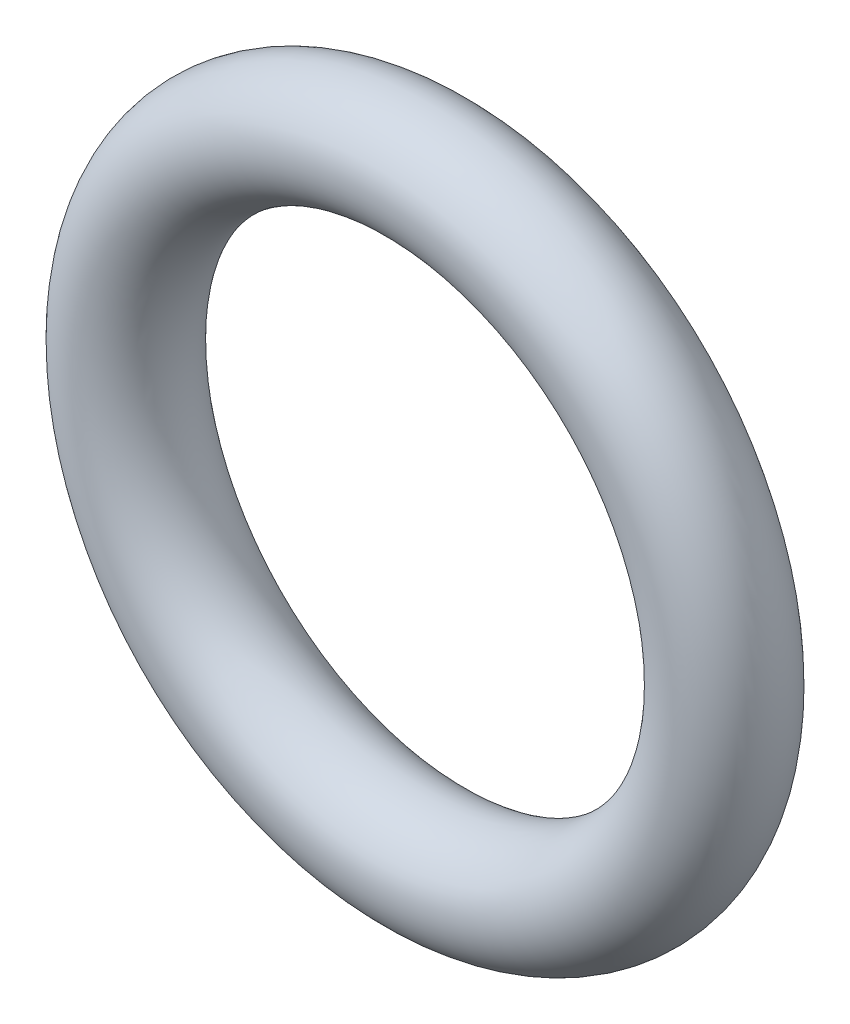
SolidWorks part; units mm, degrees
ref_plane "Front Plane" through (0, 0, 0) normal (0, 0, 1) x (1, 0, 0)
ref_plane "Top Plane" through (0, 0, 0) normal (0, 1, 0) x (1, 0, 0)
ref_plane "Right Plane" through (0, 0, 0) normal (1, 0, 0) x (0, 0, -1)
sketch "Sketch1" plane through (0, 0, 0) normal (0, 0, 1) x (1, 0, 0)
  line L0 (0, 0) -> (0, 4.7117) construction
  circle A0 centre (0, 0) radius 4.7117
  dimension "D1" = 9.4234
sketch "Sketch3" plane through (0, 0, 0) normal (1, 0, 0) x (0, 0, -1)
  line L0 (0, 0) -> (0, 4.7117) construction
  circle A0 centre (0, 4.7117) radius 0.889
  dimension "D1" = 1.778
sweep "Sweep2" add profiles "Sketch3" path "Sketch1"
